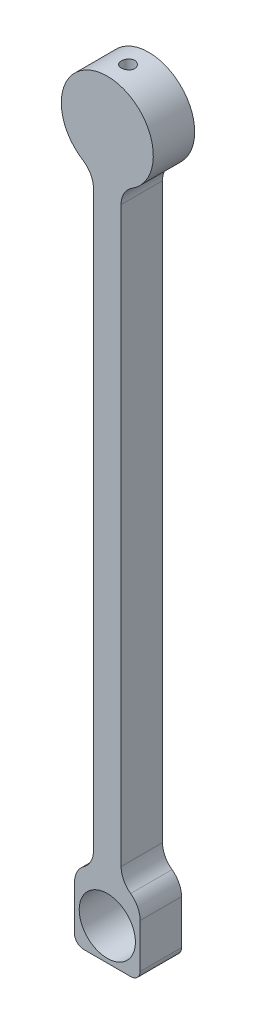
SolidWorks part; units mm, degrees
ref_plane "Front Plane" through (0, 0, 0) normal (0, 0, 1) x (1, 0, 0)
ref_plane "Top Plane" through (0, 0, 0) normal (0, 1, 0) x (1, 0, 0)
ref_plane "Right Plane" through (0, 0, 0) normal (1, 0, 0) x (0, 0, -1)
sketch "Sketch1" plane through (0, 0, 0) normal (0, 0, 1) x (1, 0, 0)
  line L5 (-1.8, 2.5239) -> (1.8, 2.5239)
  line L6 (-1.8629, 2.7239) -> (1.8629, 2.7239)
  circle A2 centre (0, 0) radius 10
  arc A4 (-1.8, 2.5239) -> (1.8, 2.5239) centre (0, 0) ccw
  arc A7 (-1.8629, 2.7239) -> (1.8629, 2.7239) centre (0, 0) ccw
  dimension "D1" = 0.2
  dimension "D4" = 20
  dimension "D2" = 6.2
  dimension "D3" = 3.6
extrude "Boss-Extrude1" add sketch "Sketch1" along normal blind 9
sketch "Sketch2" plane through (0, 0, 0) normal (0, 0, -1) x (-1, 0, 0)
  line L5 (-10, -7) -> (10, -7)
  line L6 (-10, -7) -> (-10, -10)
  line L7 (-10, -10) -> (10, -10)
  line L8 (10, -7) -> (10, -10)
  circle A1 centre (0, 0) radius 10
  circle A2 centre (0, 0) radius 10
  dimension "D2" = 3
  dimension "D1" = 0
extrude "Cut-Extrude1" cut sketch "Sketch2" against normal blind 10 contours L5 M8
sketch "Sketch3" plane through (0, -7, 0) normal (0, -1, 0) x (1, 0, 0)
  line L4 (-7.1414, 0) -> (7.1414, 0)
  line L5 (7.1414, 0) -> (7.1414, 9)
  line L6 (7.1414, 9) -> (-7.1414, 9)
  line L7 (-7.1414, 9) -> (-7.1414, 0)
  line L8 (-7.1414, 0) -> (7.1414, 0)
  line L9 (7.1414, 0) -> (7.1414, 9)
  line L10 (7.1414, 9) -> (-7.1414, 9)
  line L11 (-7.1414, 9) -> (-7.1414, 0)
  dimension "D1" = 0
extrude "Boss-Extrude2" add sketch "Sketch3" along normal blind 150
sketch "Sketch4" plane through (0, 0, 0) normal (0, 0, -1) x (-1, 0, 0)
  line L0 (7.1414, -157) -> (-7.1414, -157) construction
  circle A0 centre (0, -150) radius 6.11
  dimension "D1" = 12.22
  dimension "D2" = 7
extrude "Cut-Extrude2" cut sketch "Sketch4" against normal blind 10
fillet "Fillet1" radius 5 2 edges at (-7.1414, -7, 4.5) (7.1414, -7, 4.5)
fillet "Fillet2" radius 2 2 edges at (7.1414, -157, 4.5) (-7.1414, -157, 4.5)
sketch "Sketch5" [suppressed] plane through (0, 0, 10) normal (0, 0, 1) x (1, 0, 0)
  line L3 (-5.1414, -157) -> (5.1414, -157)
  line L4 (7.1414, -155) -> (7.1414, -8.8083)
  line L5 (-7.1414, -8.8083) -> (-7.1414, -155)
  line L6 (-5.1414, -157) -> (5.1414, -157)
  line L7 (7.1414, -155) -> (7.1414, -8.8083)
  line L8 (-7.1414, -8.8083) -> (-7.1414, -155)
  arc A5 (5.1414, -157) -> (7.1414, -155) centre (5.1414, -155) ccw
  arc A6 (8.0943, -5.8722) -> (7.1414, -8.8083) centre (12.1414, -8.8083) ccw
  arc A7 (8.0943, -5.8722) -> (-8.0943, -5.8722) centre (0, 0) ccw
  arc A8 (-7.1414, -8.8083) -> (-8.0943, -5.8722) centre (-12.1414, -8.8083) ccw
  arc A9 (-7.1414, -155) -> (-5.1414, -157) centre (-5.1414, -155) ccw
  arc A10 (5.1414, -157) -> (7.1414, -155) centre (5.1414, -155) ccw
  arc A11 (8.0943, -5.8722) -> (7.1414, -8.8083) centre (12.1414, -8.8083) ccw
  arc A12 (8.0943, -5.8722) -> (-8.0943, -5.8722) centre (0, 0) ccw
  arc A13 (-7.1414, -8.8083) -> (-8.0943, -5.8722) centre (-12.1414, -8.8083) ccw
  arc A14 (-7.1414, -155) -> (-5.1414, -157) centre (-5.1414, -155) ccw
  dimension "D1" = 0
extrude "Cut-Extrude3" [suppressed] cut sketch "Sketch5" against normal offset from surface (7 mm away) 3
sketch "Sketch6" [suppressed] plane through (0, 0, 3) normal (0, 0, 1) x (1, 0, 0)
  line L0 (7.1414, -8.8083) -> (7.1414, -155) construction
  line L1 (-7.1414, -8.8083) -> (7.1414, -8.8083)
  line L2 (-7.1414, -8.8083) -> (-7.1414, -157)
  line L3 (-7.1414, -157) -> (7.1414, -157)
  line L4 (7.1414, -8.8083) -> (7.1414, -157)
  line L5 (0, -157) -> (0, -8.8083) construction
  line L6 (-7.1414, -82.9041) -> (7.1414, -82.9041) construction
  line L7 (5.1414, -157) -> (-5.1414, -157) construction
  point P660 (0, -82.9041)
extrude "Cut-Extrude4" [suppressed] cut sketch "Sketch6" against normal through all
sketch "Sketch8" plane through (0, 0, 0) normal (0, 0, -1) x (-1, 0, 0)
  line L0 (0, 0) -> (0, -150)
  line L1 (-3, -12.6886) -> (3, -12.6886) construction
  line L2 (-3, -12.6886) -> (-3, -137.3114)
  line L3 (-7.1414, -8.8083) -> (-7.1414, -155)
  line L4 (-5.1414, -157) -> (5.1414, -157)
  line L5 (7.1414, -155) -> (7.1414, -8.8083)
  line L6 (-7.1414, -8.8083) -> (-7.1414, -155)
  line L7 (-5.1414, -157) -> (5.1414, -157)
  line L8 (7.1414, -155) -> (7.1414, -8.8083)
  line L9 (-3, -137.3114) -> (3, -137.3114) construction
  line L10 (3, -12.6886) -> (3, -137.3114)
  line L11 (0, -137.3114) -> (0, -12.6886) construction
  line L12 (-3, -75) -> (3, -75) construction
  arc A0 (-8.0943, -5.8722) -> (-5.3333, -8.4591) centre (0, 0) ccw
  arc A1 (-5.3333, -141.5409) -> (-7.1414, -143) centre (0, -150) ccw
  arc A2 (-5.3333, -8.4591) -> (-3, -12.6886) centre (-8, -12.6886) cw
  arc A3 (-5.3333, -141.5409) -> (-3, -137.3114) centre (-8, -137.3114) ccw
  arc A4 (8.0943, -5.8722) -> (5.3333, -8.4591) centre (0, 0) cw
  arc A5 (-7.1414, -155) -> (-5.1414, -157) centre (-5.1414, -155) ccw
  arc A6 (5.1414, -157) -> (7.1414, -155) centre (5.1414, -155) ccw
  arc A7 (8.0943, -5.8722) -> (7.1414, -8.8083) centre (12.1414, -8.8083) ccw
  arc A8 (8.0943, -5.8722) -> (-8.0943, -5.8722) centre (0, 0) ccw
  arc A9 (-7.1414, -8.8083) -> (-8.0943, -5.8722) centre (-12.1414, -8.8083) ccw
  arc A10 (-7.1414, -155) -> (-5.1414, -157) centre (-5.1414, -155) ccw
  arc A11 (5.1414, -157) -> (7.1414, -155) centre (5.1414, -155) ccw
  arc A12 (8.0943, -5.8722) -> (7.1414, -8.8083) centre (12.1414, -8.8083) ccw
  arc A14 (-7.1414, -8.8083) -> (-8.0943, -5.8722) centre (-12.1414, -8.8083) ccw
  arc A15 (5.3333, -8.4591) -> (3, -12.6886) centre (8, -12.6886) ccw
  arc A16 (5.3333, -141.5409) -> (7.1414, -143) centre (0, -150) cw
  arc A17 (5.3333, -141.5409) -> (3, -137.3114) centre (8, -137.3114) cw
  point P193 (0, -75)
  dimension "D2" = 6
  dimension "D3" = 5
  dimension "D1" = 0
extrude "Cut-Extrude5" cut sketch "Sketch8" against normal through all and the other way through all contours A1 A3 L2 A2 A0 M27 M20 | A17 A16 L8 A4 A15 L10 M25
fillet "Fillet3" radius 5 2 edges
sketch "Sketch9" plane through (0, 0, 9) normal (0, 0, 1) x (1, 0, 0)
  line L0 (-1.8629, 2.7239) -> (1.8629, 2.7239) construction
  line L1 (-1.8629, 2.7239) -> (1.8629, 2.7239)
  arc A0 (-1.8629, 2.7239) -> (1.8629, 2.7239) centre (0, 0) ccw construction
  arc A1 (-1.8629, 2.7239) -> (1.8629, 2.7239) centre (0, 0) ccw
extrude "Boss-Extrude3" add sketch "Sketch9" against normal blind 2
ref_plane "Plane1" through (0, 10, 0) normal (0, 1, 0) x (1, 0, 0)
sketch "Sketch10" plane through (0, 10, 0) normal (0, 1, 0) x (1, 0, 0)
  circle A0 centre (0, -4.5) radius 1.45
  dimension "D1" = 2.9
  dimension "D2" = 4.5
extrude "Cut-Extrude6" cut sketch "Sketch10" against normal blind 10
